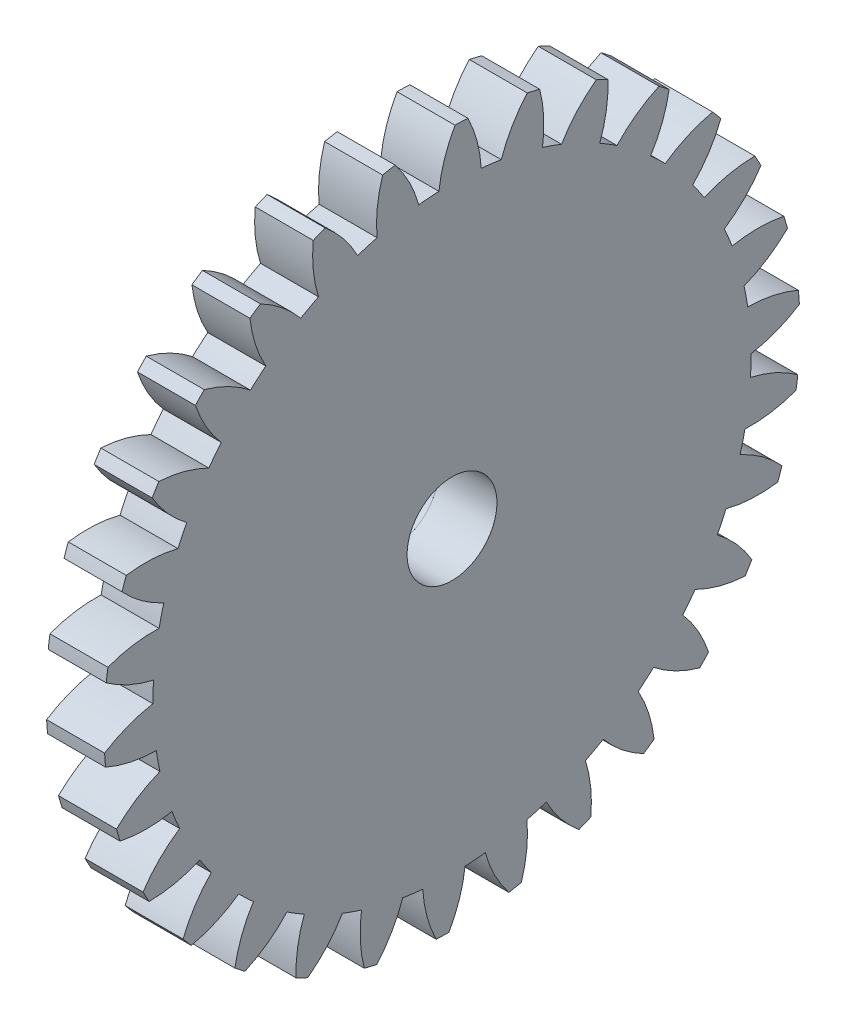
SolidWorks part; units mm, degrees
ref_plane "Alzado" through (0, 0, 0) normal (0, 0, 1) x (1, 0, 0)
ref_plane "Planta" through (0, 0, 0) normal (0, 1, 0) x (1, 0, 0)
ref_plane "Vista lateral" through (0, 0, 0) normal (1, 0, 0) x (0, 0, -1)
imported_body "spur gear_din-1-solid1"
imported_body "spur gear_din-2-solid1"
sketch "Croquis1" plane through (-12.8421, 0, 0) normal (-1, 0, 0) x (0, 0, 1)
  circle A0 centre (0, 2.352) radius 1.55
  dimension "D1" = 3.1
extrude "Cortar-Extruir1" cut sketch "Croquis1" against normal through all both and the other way through all
